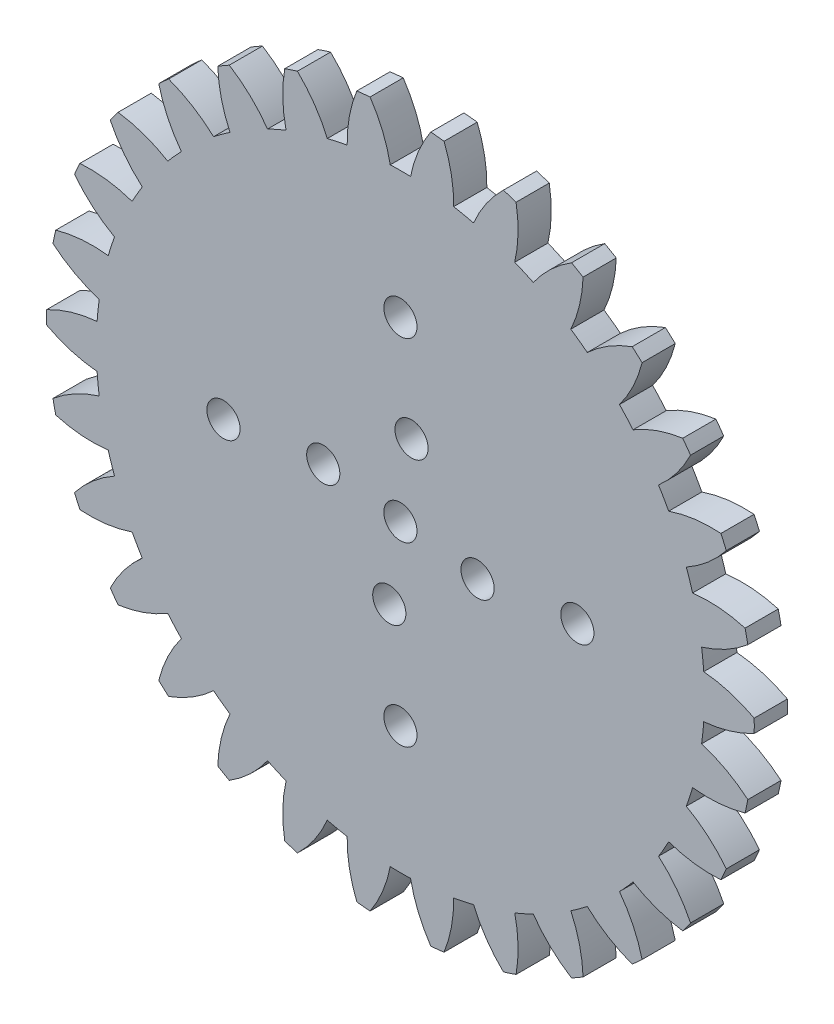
SolidWorks part; units mm, degrees
ref_plane "前视基准面" through (0, 0, 0) normal (0, 0, 1) x (1, 0, 0)
ref_plane "上视基准面" through (0, 0, 0) normal (0, 1, 0) x (1, 0, 0)
ref_plane "右视基准面" through (0, 0, 0) normal (1, 0, 0) x (0, 0, -1)
sketch "草图1" plane through (0, 0, 0) normal (0, 0, 1) x (1, 0, 0)
  arc A0 (-88.7346, 50.606) -> (-84.1694, 49.2488) centre (-83.1005, 61.2011) ccw
  arc A1 (-84.1694, 49.2488) -> (-83.9774, 47.4218) centre (-56.7403, 51.2081) ccw
  arc A2 (-83.9774, 47.4218) -> (-88.1607, 45.1451) centre (-80.4468, 35.9529) ccw
  arc A3 (-88.1607, 45.1451) -> (-87.9103, 43.9672) centre (-56.7403, 51.2081) ccw
  arc A4 (-87.9103, 43.9672) -> (-83.1627, 43.5888) centre (-84.6021, 55.5021) ccw
  arc A5 (-83.1627, 43.5888) -> (-82.595, 41.8416) centre (-56.7403, 51.2081) ccw
  arc A6 (-82.595, 41.8416) -> (-86.2135, 38.7449) centre (-76.757, 31.3574) ccw
  arc A7 (-86.2135, 38.7449) -> (-85.7237, 37.6448) centre (-56.7403, 51.2081) ccw
  arc A8 (-85.7237, 37.6448) -> (-81.0011, 38.2618) centre (-84.8861, 49.6155) ccw
  arc A9 (-81.0011, 38.2618) -> (-80.0826, 36.6708) centre (-56.7403, 51.2081) ccw
  arc A10 (-80.0826, 36.6708) -> (-82.9782, 32.8894) centre (-72.1924, 27.6295) ccw
  arc A11 (-82.9782, 32.8894) -> (-82.2703, 31.9152) centre (-56.7403, 51.2081) ccw
  arc A12 (-82.2703, 31.9152) -> (-77.7793, 33.5006) centre (-83.9399, 43.7985) ccw
  arc A13 (-77.7793, 33.5006) -> (-76.55, 32.1353) centre (-56.7403, 51.2081) ccw
  arc A14 (-76.55, 32.1353) -> (-78.5962, 27.8346) centre (-66.9525, 24.9321) ccw
  arc A15 (-78.5962, 27.8346) -> (-77.7012, 27.0288) centre (-56.7403, 51.2081) ccw
  arc A16 (-77.7012, 27.0288) -> (-73.6379, 29.5133) centre (-81.805, 38.3053) ccw
  arc A17 (-73.6379, 29.5133) -> (-72.1517, 28.4335) centre (-56.7403, 51.2081) ccw
  arc A18 (-72.1517, 28.4335) -> (-73.2589, 23.8013) centre (-61.2662, 23.383) ccw
  arc A19 (-73.2589, 23.8013) -> (-72.216, 23.1992) centre (-56.7403, 51.2081) ccw
  arc A20 (-72.216, 23.1992) -> (-68.758, 26.4742) centre (-78.5746, 33.376) ccw
  arc A21 (-68.758, 26.4742) -> (-67.0798, 25.7269) centre (-56.7403, 51.2081) ccw
  arc A22 (-67.0798, 25.7269) -> (-67.1997, 20.9658) centre (-55.3821, 23.0501) ccw
  arc A23 (-67.1997, 20.9658) -> (-66.0544, 20.5936) centre (-56.7403, 51.2081) ccw
  arc A24 (-66.0544, 20.5936) -> (-63.353, 24.516) centre (-74.3899, 29.2261) ccw
  arc A25 (-63.353, 24.516) -> (-61.556, 24.1341) centre (-56.7403, 51.2081) ccw
  arc A26 (-61.556, 24.1341) -> (-60.6834, 19.452) centre (-49.5574, 23.9478) ccw
  arc A27 (-60.6834, 19.452) -> (-59.4858, 19.3261) centre (-56.7403, 51.2081) ccw
  arc A28 (-59.4858, 19.3261) -> (-57.6588, 23.7245) centre (-69.4339, 26.0369) ccw
  arc A29 (-57.6588, 23.7245) -> (-55.8217, 23.7245) centre (-56.7403, 51.2081) ccw
  arc A30 (-55.8217, 23.7245) -> (-53.9948, 19.3261) centre (-44.0467, 26.0369) ccw
  arc A31 (-53.9948, 19.3261) -> (-52.7972, 19.452) centre (-56.7403, 51.2081) ccw
  arc A32 (-52.7972, 19.452) -> (-51.9246, 24.1341) centre (-63.9232, 23.9478) ccw
  arc A33 (-51.9246, 24.1341) -> (-50.1276, 24.516) centre (-56.7403, 51.2081) ccw
  arc A34 (-50.1276, 24.516) -> (-47.4262, 20.5936) centre (-39.0906, 29.2261) ccw
  arc A35 (-47.4262, 20.5936) -> (-46.2809, 20.9658) centre (-56.7403, 51.2081) ccw
  arc A36 (-46.2809, 20.9658) -> (-46.4008, 25.7269) centre (-58.0985, 23.0501) ccw
  arc A37 (-46.4008, 25.7269) -> (-44.7226, 26.4742) centre (-56.7403, 51.2081) ccw
  arc A38 (-44.7226, 26.4742) -> (-41.2646, 23.1992) centre (-34.906, 33.376) ccw
  arc A39 (-41.2646, 23.1992) -> (-40.2217, 23.8013) centre (-56.7403, 51.2081) ccw
  arc A40 (-40.2217, 23.8013) -> (-41.3289, 28.4335) centre (-52.2144, 23.383) ccw
  arc A41 (-41.3289, 28.4335) -> (-39.8427, 29.5133) centre (-56.7403, 51.2081) ccw
  arc A42 (-39.8427, 29.5133) -> (-35.7794, 27.0288) centre (-31.6756, 38.3053) ccw
  arc A43 (-35.7794, 27.0288) -> (-34.8844, 27.8346) centre (-56.7403, 51.2081) ccw
  arc A44 (-34.8844, 27.8346) -> (-36.9306, 32.1353) centre (-46.5281, 24.9321) ccw
  arc A45 (-36.9306, 32.1353) -> (-35.7013, 33.5006) centre (-56.7403, 51.2081) ccw
  arc A46 (-35.7013, 33.5006) -> (-31.2103, 31.9152) centre (-29.5407, 43.7985) ccw
  arc A47 (-31.2103, 31.9152) -> (-30.5024, 32.8894) centre (-56.7403, 51.2081) ccw
  arc A48 (-30.5024, 32.8894) -> (-33.398, 36.6708) centre (-41.2882, 27.6295) ccw
  arc A49 (-33.398, 36.6708) -> (-32.4795, 38.2618) centre (-56.7403, 51.2081) ccw
  arc A50 (-32.4795, 38.2618) -> (-27.7569, 37.6448) centre (-28.5945, 49.6155) ccw
  arc A51 (-27.7569, 37.6448) -> (-27.2671, 38.7449) centre (-56.7403, 51.2081) ccw
  arc A52 (-27.2671, 38.7449) -> (-30.8856, 41.8416) centre (-36.7236, 31.3574) ccw
  arc A53 (-30.8856, 41.8416) -> (-30.3179, 43.5888) centre (-56.7403, 51.2081) ccw
  arc A54 (-30.3179, 43.5888) -> (-25.5703, 43.9672) centre (-28.8785, 55.5021) ccw
  arc A55 (-25.5703, 43.9672) -> (-25.3199, 45.1451) centre (-56.7403, 51.2081) ccw
  arc A56 (-25.3199, 45.1451) -> (-29.5032, 47.4218) centre (-33.0338, 35.9529) ccw
  arc A57 (-29.5032, 47.4218) -> (-29.3112, 49.2488) centre (-56.7403, 51.2081) ccw
  arc A58 (-29.3112, 49.2488) -> (-24.746, 50.606) centre (-30.3801, 61.2011) ccw
  arc A59 (-24.746, 50.606) -> (-24.746, 51.8102) centre (-56.7403, 51.2081) ccw
  arc A60 (-24.746, 51.8102) -> (-29.3112, 53.1674) centre (-30.3801, 41.2151) ccw
  arc A61 (-29.3112, 53.1674) -> (-29.5032, 54.9945) centre (-56.7403, 51.2081) ccw
  arc A62 (-29.5032, 54.9945) -> (-25.3199, 57.2711) centre (-33.0338, 66.4633) ccw
  arc A63 (-25.3199, 57.2711) -> (-25.5703, 58.4491) centre (-56.7403, 51.2081) ccw
  arc A64 (-25.5703, 58.4491) -> (-30.3179, 58.8274) centre (-28.8785, 46.9141) ccw
  arc A65 (-30.3179, 58.8274) -> (-30.8856, 60.5746) centre (-56.7403, 51.2081) ccw
  arc A66 (-30.8856, 60.5746) -> (-27.2671, 63.6713) centre (-36.7236, 71.0588) ccw
  arc A67 (-27.2671, 63.6713) -> (-27.7569, 64.7715) centre (-56.7403, 51.2081) ccw
  arc A68 (-27.7569, 64.7715) -> (-32.4795, 64.1545) centre (-28.5945, 52.8007) ccw
  arc A69 (-32.4795, 64.1545) -> (-33.398, 65.7454) centre (-56.7403, 51.2081) ccw
  arc A70 (-33.398, 65.7454) -> (-30.5024, 69.5268) centre (-41.2882, 74.7868) ccw
  arc A71 (-30.5024, 69.5268) -> (-31.2103, 70.501) centre (-56.7403, 51.2081) ccw
  arc A72 (-31.2103, 70.501) -> (-35.7013, 68.9157) centre (-29.5407, 58.6178) ccw
  arc A73 (-35.7013, 68.9157) -> (-36.9306, 70.2809) centre (-56.7403, 51.2081) ccw
  arc A74 (-36.9306, 70.2809) -> (-34.8844, 74.5816) centre (-46.5281, 77.4842) ccw
  arc A75 (-34.8844, 74.5816) -> (-35.7794, 75.3874) centre (-56.7403, 51.2081) ccw
  arc A76 (-35.7794, 75.3874) -> (-39.8427, 72.903) centre (-31.6756, 64.1109) ccw
  arc A77 (-39.8427, 72.903) -> (-41.3289, 73.9828) centre (-56.7403, 51.2081) ccw
  arc A78 (-41.3289, 73.9828) -> (-40.2217, 78.615) centre (-52.2144, 79.0332) ccw
  arc A79 (-40.2217, 78.615) -> (-41.2646, 79.2171) centre (-56.7403, 51.2081) ccw
  arc A80 (-41.2646, 79.2171) -> (-44.7226, 75.9421) centre (-34.906, 69.0402) ccw
  arc A81 (-44.7226, 75.9421) -> (-46.4008, 76.6893) centre (-56.7403, 51.2081) ccw
  arc A82 (-46.4008, 76.6893) -> (-46.2809, 81.4505) centre (-58.0985, 79.3662) ccw
  arc A83 (-46.2809, 81.4505) -> (-47.4262, 81.8226) centre (-56.7403, 51.2081) ccw
  arc A84 (-47.4262, 81.8226) -> (-50.1276, 77.9002) centre (-39.0906, 73.1902) ccw
  arc A85 (-50.1276, 77.9002) -> (-51.9246, 78.2822) centre (-56.7403, 51.2081) ccw
  arc A86 (-51.9246, 78.2822) -> (-52.7972, 82.9642) centre (-63.9232, 78.4685) ccw
  arc A87 (-52.7972, 82.9642) -> (-53.9948, 83.0901) centre (-56.7403, 51.2081) ccw
  arc A88 (-53.9948, 83.0901) -> (-55.8217, 78.6918) centre (-44.0467, 76.3794) ccw
  arc A89 (-55.8217, 78.6918) -> (-57.6588, 78.6918) centre (-56.7403, 51.2081) ccw
  arc A90 (-57.6588, 78.6918) -> (-59.4858, 83.0901) centre (-69.4339, 76.3794) ccw
  arc A91 (-59.4858, 83.0901) -> (-60.6834, 82.9642) centre (-56.7403, 51.2081) ccw
  arc A92 (-60.6834, 82.9642) -> (-61.556, 78.2822) centre (-49.5574, 78.4685) ccw
  arc A93 (-61.556, 78.2822) -> (-63.353, 77.9002) centre (-56.7403, 51.2081) ccw
  arc A94 (-63.353, 77.9002) -> (-66.0544, 81.8226) centre (-74.3899, 73.1902) ccw
  arc A95 (-66.0544, 81.8226) -> (-67.1997, 81.4505) centre (-56.7403, 51.2081) ccw
  arc A96 (-67.1997, 81.4505) -> (-67.0798, 76.6893) centre (-55.3821, 79.3662) ccw
  arc A97 (-67.0798, 76.6893) -> (-68.758, 75.9421) centre (-56.7403, 51.2081) ccw
  arc A98 (-68.758, 75.9421) -> (-72.216, 79.2171) centre (-78.5746, 69.0402) ccw
  arc A99 (-72.216, 79.2171) -> (-73.2589, 78.615) centre (-56.7403, 51.2081) ccw
  arc A100 (-73.2589, 78.615) -> (-72.1517, 73.9828) centre (-61.2662, 79.0332) ccw
  arc A101 (-72.1517, 73.9828) -> (-73.6379, 72.903) centre (-56.7403, 51.2081) ccw
  arc A102 (-73.6379, 72.903) -> (-77.7012, 75.3874) centre (-81.805, 64.1109) ccw
  arc A103 (-77.7012, 75.3874) -> (-78.5962, 74.5816) centre (-56.7403, 51.2081) ccw
  arc A104 (-78.5962, 74.5816) -> (-76.55, 70.2809) centre (-66.9525, 77.4842) ccw
  arc A105 (-76.55, 70.2809) -> (-77.7793, 68.9157) centre (-56.7403, 51.2081) ccw
  arc A106 (-77.7793, 68.9157) -> (-82.2703, 70.501) centre (-83.9399, 58.6178) ccw
  arc A107 (-82.2703, 70.501) -> (-82.9782, 69.5268) centre (-56.7403, 51.2081) ccw
  arc A108 (-82.9782, 69.5268) -> (-80.0826, 65.7454) centre (-72.1924, 74.7868) ccw
  arc A109 (-80.0826, 65.7454) -> (-81.0011, 64.1545) centre (-56.7403, 51.2081) ccw
  arc A110 (-81.0011, 64.1545) -> (-85.7237, 64.7715) centre (-84.8861, 52.8007) ccw
  arc A111 (-85.7237, 64.7715) -> (-86.2135, 63.6713) centre (-56.7403, 51.2081) ccw
  arc A112 (-86.2135, 63.6713) -> (-82.595, 60.5746) centre (-76.757, 71.0588) ccw
  arc A113 (-82.595, 60.5746) -> (-83.1627, 58.8274) centre (-56.7403, 51.2081) ccw
  arc A114 (-83.1627, 58.8274) -> (-87.9103, 58.4491) centre (-84.6021, 46.9141) ccw
  arc A115 (-87.9103, 58.4491) -> (-88.1607, 57.2711) centre (-56.7403, 51.2081) ccw
  arc A116 (-88.1607, 57.2711) -> (-83.9774, 54.9945) centre (-80.4468, 66.4633) ccw
  arc A117 (-83.9774, 54.9945) -> (-84.1694, 53.1674) centre (-56.7403, 51.2081) ccw
  arc A118 (-84.1694, 53.1674) -> (-88.7346, 51.8102) centre (-83.1005, 41.2151) ccw
  arc A119 (-88.7346, 51.8102) -> (-88.7346, 50.606) centre (-56.7403, 51.2081) ccw
extrude "凸台-拉伸1" add sketch "草图1" along normal blind 3
sketch "草图2" plane through (0, 0, 3) normal (0, 0, 1) x (1, 0, 0)
  circle A0 centre (-56.7403, 51.2081) radius 16 construction
  circle A1 centre (-56.7403, 67.2081) radius 1.5
  circle A2 centre (-40.7403, 51.2081) radius 1.5
  circle A3 centre (-56.7403, 35.2081) radius 1.5
  circle A4 centre (-72.7403, 51.2081) radius 1.5
  point P14 (-56.7403, 51.2081)
  dimension "D1" = 4
extrude "切除-拉伸1" cut sketch "草图2" against normal blind 10
sketch "草图3" plane through (0, 0, 3) normal (0, 0, 1) x (1, 0, 0)
  circle A0 centre (-56.7403, 51.2081) radius 1.5
extrude "切除-拉伸2" cut sketch "草图3" against normal blind 10
sketch "草图4" plane through (0, 0, 3) normal (0, 0, 1) x (1, 0, 0)
  line L0 (-84.1694, 53.1674) -> (-102.4271, 70.5128)
  line L1 (-102.4271, 70.5128) -> (-65.9897, 86.3023)
  line L2 (-65.9897, 86.3023) -> (-22.2648, 82.5371)
  line L3 (-22.2648, 82.5371) -> (-9.1473, 61.8401)
  line L4 (-9.1473, 61.8401) -> (-9.1473, 58.4885)
  line L5 (-29.3112, 53.1674) -> (-9.1473, 58.4885)
  arc A0 (-84.1694, 53.1674) -> (-29.3112, 53.1674) centre (-56.7403, 42) cw
sketch "草图5" plane through (0, 0, 3) normal (0, 0, 1) x (1, 0, 0)
  circle A0 centre (-49.7624, 50.2024) radius 1.5
  circle A1 centre (-55.7346, 58.186) radius 1.5
  circle A2 centre (-63.7182, 52.2139) radius 1.5
  circle A3 centre (-57.746, 44.2302) radius 1.5
extrude "切除-拉伸3" cut sketch "草图5" against normal up to next
sketch "草图6" plane through (0, 0, 3) normal (0, 0, 1) x (1, 0, 0)
  circle A2 centre (-56.7403, 51.2081) radius 29.75 construction
